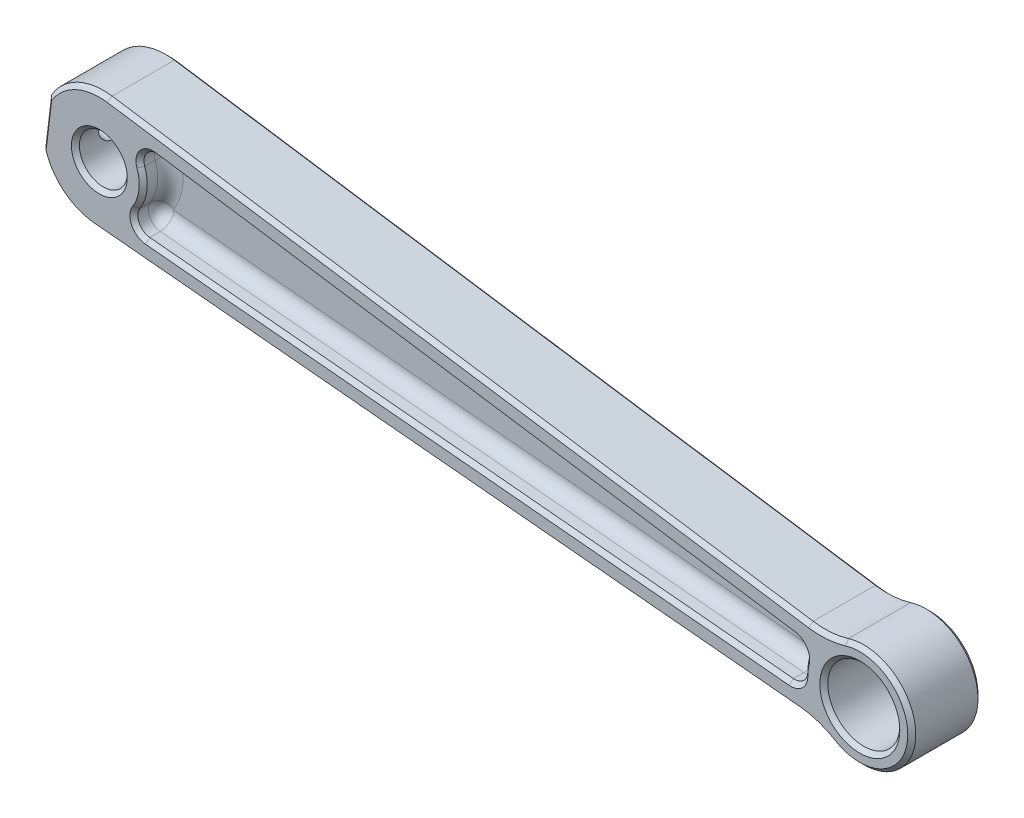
SolidWorks part; units mm, degrees
ref_plane "Front" through (0, 0, 0) normal (0, 0, 1) x (1, 0, 0)
ref_plane "Top" through (0, 0, 0) normal (0, 1, 0) x (1, 0, 0)
ref_plane "Right" through (0, 0, 0) normal (1, 0, 0) x (0, 0, -1)
ref_plane "Front-2.74_00_000" through (0, 0, 0) normal (0, 0, 1) x (1, 0, 0)
ref_plane "Top-2.74_00_000" through (0, 0, 0) normal (0, 1, 0) x (1, 0, 0)
ref_plane "Right-2.74_00_000" through (0, 0, 0) normal (1, 0, 0) x (0, 0, -1)
sketch "layout-2.74_00_000" plane through (0, 0, 0) normal (0, 0, 1) x (1, 0, 0)
  line L0 (0, -7) -> (10.8027, -56.8428) construction
  line L7 (10.8027, -56.8428) -> (106.1067, -68.3815) construction
  line L8 (4.2363, -26.5462) -> (99.5404, -38.0849) construction
  line L9 (99.5404, -38.0849) -> (126.4411, -162.2032) construction
  line L10 (17, 41.5) -> (-7.5, 41.5) construction
  line L11 (20, 55) -> (20, 0)
  line L12 (20, 55) -> (-20, 55)
  line L13 (-20, 55) -> (-20, 0)
  line L14 (-7.5, 51.5) -> (7.5, 51.5) construction
  line L15 (7.5, 51.5) -> (7.5, 31.5) construction
  line L17 (-7.5, 51.5) -> (-7.5, 31.5) construction
  line L18 (7.5, 31.5) -> (-7.5, 31.5) construction
  line L19 (17, 55) -> (17, 28)
  line L20 (17, 55) -> (-17, 55)
  line L21 (-17, 55) -> (-17, 28)
  line L22 (17, 28) -> (-17, 28)
  line L23 (0, 55) -> (0, 41.5) construction
  circle A0 centre (7.5, 51.5) radius 1.55
  circle A9 centre (7.5, 31.5) radius 1.55
  circle A10 centre (-7.5, 31.5) radius 1.55
  circle A11 centre (-7.5, 51.5) radius 1.55
  circle A12 centre (0, 0) radius 20
  circle B0 centre (0, 0) radius 15.5 construction
  circle B1 centre (0, -7) radius 6.25
  circle B2 centre (0, 0) radius 20
  circle B3 centre (15.5, 0) radius 1.5
  circle B4 centre (7.75, -13.4234) radius 1.5
  circle B5 centre (-7.75, -13.4234) radius 1.5
  circle B6 centre (-15.5, 0) radius 1.5
  circle B7 centre (-7.75, 13.4234) radius 1.5
  circle B8 centre (7.75, 13.4234) radius 1.5
  circle B9 centre (0, 0) radius 18.4
  circle B10 centre (0, -7) radius 3
  circle B11 centre (9.3199, -50.0016) radius 15.5 construction
  circle B12 centre (10.8027, -56.8428) radius 6.25
  circle B13 centre (9.3199, -50.0016) radius 20
  circle B14 centre (24.4682, -46.7185) radius 1.5
  circle B15 centre (19.7374, -61.4788) radius 1.5
  circle B16 centre (4.5891, -64.762) radius 1.5
  circle B17 centre (-5.8284, -53.2848) radius 1.5
  circle B18 centre (-1.0975, -38.5244) radius 1.5
  circle B19 centre (14.0508, -35.2412) radius 1.5
  circle B20 centre (9.3199, -50.0016) radius 18.4
  circle B21 centre (10.8027, -56.8428) radius 3
sketch_block_instance "motorMount-2-1"
sketch_block "motorMount-2" parameters "D1"=31, "D2"=12.5, "D4"=40, "D5"=3, "D6"=36.8, "D7"=5.828, "D3"=7
sketch_block_instance "motorMount-2" parameters "D1"=39.5436, "D3"=12.0659, "D5"=37.1352, "D6"=2.3003, "D8"=36.8, "D11"=35.5941, "D9"=3.2987, "D4"=6.928, "D7"=74.6883, "D2"=59.5318, "D10"=34
ref_plane "profile plane-2.74_00_000" through (-1.4491, -0.3141, 0) normal (-0.9773, -0.2118, 0) x (0.2118, -0.9773, 0)
sketch "profile-2.74_00_000" plane through (1.4811, -13.8336, 0) normal (0.9773, 0.2118, 0) x (-0.2118, 0.9773, 0)
  line L1 (-44.0077, 0) -> (-44.0077, 36.4175) construction
  line L2 (-13.0077, 0) -> (-13.0077, 31.3) construction
  line L3 (11.2423, 12.5) -> (-17.0077, 12.5)
  line L4 (6.9923, 0) -> (6.9923, 30.0757) construction
  line L5 (-0.5077, 11.3) -> (14.4923, 11.3)
  line L6 (-0.5077, 11.3) -> (-0.5077, 6.3)
  line L7 (-0.5077, 6.3) -> (14.4923, 6.3)
  line L8 (14.4923, 11.3) -> (14.4923, 6.3)
  line L9 (3.9923, 11.3) -> (3.9923, 6.3)
  line L10 (9.9923, 11.3) -> (9.9923, 6.3)
  line L15 (-0.5204, 11.3) -> (-0.5204, 6.3)
  line L16 (0.7296, 6.3) -> (0.7296, 0)
  line L17 (0.7296, 0) -> (33.7784, 0)
  line L18 (33.7784, 0) -> (33.7784, 11.3)
  line L19 (33.7784, 11.3) -> (-0.5204, 11.3)
  line L20 (2.7423, 12.5) -> (2.7423, 11.3)
  line L21 (2.7423, 11.3) -> (11.2423, 11.3)
  line L22 (11.2423, 12.5) -> (11.2423, 11.3)
  line L23 (15.9923, 20.5) -> (-51.5204, 20.5)
  line L24 (15.9923, 20.5) -> (15.9923, 12.5)
  line L25 (15.9923, 12.5) -> (2.7423, 12.5)
  line L26 (-51.5204, 20.5) -> (-51.5204, 15.2)
  line L27 (15.9923, 18.5) -> (9.9923, 18.5)
  line L28 (15.9923, 18.5) -> (15.9923, 14.5)
  line L29 (15.9923, 14.5) -> (9.9923, 14.5)
  line L30 (9.9923, 18.5) -> (9.9923, 14.5)
  line L31 (-0.5204, 6.3) -> (0.7296, 6.3)
  line L33 (14.505, 11.3) -> (14.505, 6.3)
  line L34 (-51.5077, 20.5) -> (-36.5077, 20.5)
  line L35 (-51.5077, 20.5) -> (-51.5077, 15.5)
  line L36 (-51.5077, 15.5) -> (-36.5077, 15.5)
  line L37 (-36.5077, 20.5) -> (-36.5077, 15.5)
  line L38 (14.505, 6.3) -> (13.255, 6.3)
  line L39 (13.255, 6.3) -> (13.255, 0)
  line L40 (13.255, 0) -> (-6.1115, 0)
  line L41 (-6.1115, 0) -> (-6.1115, 11.3)
  line L42 (-6.1115, 11.3) -> (14.505, 11.3)
  line L43 (11.2423, 12.5) -> (11.2423, 20.5) construction
  line L44 (2.7423, 12.5) -> (11.2423, 12.5) construction
  line L45 (8.3163, 6) -> (8.3163, 6.3) construction
  line L46 (-50.2577, 15.2) -> (-50.2577, 15.5) construction
  line L47 (-51.5204, 15.2) -> (-50.2704, 15.2)
  line L48 (-48.2577, 22.7) -> (-39.7577, 22.7) construction
  line L49 (-48.2577, 22.7) -> (-48.2577, 21.5)
  line L50 (-48.2577, 21.5) -> (-39.7577, 21.5)
  line L51 (-39.7577, 22.7) -> (-39.7577, 21.5)
  line L56 (-50.2704, 15.2) -> (-50.2704, 9.2)
  line L57 (-50.2704, 9.2) -> (-17.0077, 9.2)
  line L58 (-37.0077, 9.2) -> (-37.0077, 0) construction
  line L59 (-17.0077, 9.2) -> (-57.0077, 9.2)
  line L60 (-17.0077, 9.2) -> (-17.0077, -55.8)
  line L61 (-17.0077, -55.8) -> (-57.0077, -55.8)
  line L62 (-57.0077, 9.2) -> (-57.0077, -55.8)
  line L63 (-17.5204, 29.8) -> (-17.5204, 21.8)
  line L64 (-17.5204, 21.8) -> (-16.7204, 21.8)
  line L65 (-17.0077, 9.2) -> (-17.0077, 12.5)
  line L66 (-16.7204, 21.8) -> (-16.7204, 21)
  line L67 (-17.5077, 25.8) -> (-8.5077, 25.8)
  line L68 (-17.5077, 25.8) -> (-17.5077, 21.8)
  line L69 (-17.5077, 21.8) -> (-8.5077, 21.8)
  line L70 (-8.5077, 25.8) -> (-8.5077, 21.8)
  line L71 (-15.0077, 31.3) -> (-11.0077, 31.3)
  line L72 (-15.0077, 31.3) -> (-15.0077, 12.5)
  line L73 (-15.0077, 12.5) -> (-11.0077, 12.5)
  line L74 (-11.0077, 31.3) -> (-11.0077, 12.5)
  line L75 (-17.5077, 29.8) -> (-8.5077, 29.8)
  line L76 (-17.5077, 29.8) -> (-17.5077, 25.8)
  line L77 (-17.5077, 25.8) -> (-8.5077, 25.8)
  line L78 (-8.5077, 29.8) -> (-8.5077, 25.8)
  line L79 (-19.5204, 29.8) -> (-6.495, 29.8)
  line L80 (-19.5204, 29.8) -> (-19.5204, 21)
  line L81 (-19.5204, 21) -> (-16.7204, 21)
  line L83 (-15.0077, 20.5) -> (-15.0077, 21.8)
  line L84 (-6.495, 29.8) -> (-6.495, 21)
  line L85 (-6.495, 21) -> (-9.295, 21)
  line L86 (-9.295, 21.8) -> (-9.295, 21)
  line L87 (-8.495, 21.8) -> (-9.295, 21.8)
  line L88 (-8.495, 29.8) -> (-8.495, 21.8)
  line L89 (-15.0077, 21.8) -> (-15.8077, 21.8)
  line L90 (-15.8077, 21.8) -> (-15.8077, 20.5)
  line L91 (-19.5204, 31.3) -> (-16.3204, 31.3)
  line L92 (-16.2577, 30.3) -> (-14.9077, 30.3)
  line L93 (-16.2577, 30.3) -> (-16.2577, 29.8)
  line L94 (-16.2577, 29.8) -> (-14.9077, 29.8)
  line L95 (-14.9077, 30.3) -> (-14.9077, 29.8)
  line L96 (-19.5204, 31.3) -> (-19.5204, 29.8)
  line L97 (-19.5204, 29.8) -> (-16.3204, 29.8)
  line L98 (-16.3204, 31.3) -> (-16.3204, 29.8)
  point P75 (-17.0077, 0)
  line B0 (6.9923, 0) -> (6.9923, 21.6) construction
  line B1 (0.7423, 0) -> (13.2423, 0)
  line B2 (0.7423, 0) -> (0.7423, 6)
  line B3 (0.7423, 6) -> (13.2423, 6)
  line B4 (13.2423, 0) -> (13.2423, 6)
  line B5 (3.9923, 0) -> (9.9923, 0)
  line B6 (3.9923, 0) -> (3.9923, 21.6)
  line B7 (3.9923, 21.6) -> (9.9923, 21.6)
  line B8 (9.9923, 0) -> (9.9923, 21.6)
  line B9 (3.9923, 9.6) -> (9.9923, 9.6) construction
  line B10 (-44.0077, 9.2) -> (-44.0077, 30.8) construction
  line B11 (-50.2577, 9.2) -> (-37.7577, 9.2)
  line B12 (-50.2577, 9.2) -> (-50.2577, 15.2)
  line B13 (-50.2577, 15.2) -> (-37.7577, 15.2)
  line B14 (-37.7577, 9.2) -> (-37.7577, 15.2)
  line B15 (-47.0077, 9.2) -> (-41.0077, 9.2)
  line B16 (-47.0077, 9.2) -> (-47.0077, 30.8)
  line B17 (-47.0077, 30.8) -> (-41.0077, 30.8)
  line B18 (-41.0077, 9.2) -> (-41.0077, 30.8)
  line B19 (-47.0077, 18.8) -> (-41.0077, 18.8) construction
sketch_block_instance "motorShaft-2-2"
sketch_block "motorShaft-2" parameters "D1"=6, "D2"=15.6, "D3"=12
sketch_block_instance "motorShaft-2" parameters "D1"=10.3781, "D2"=6.071, "D3"=6.071, "D4"=0.9006, "D5"=1.18, "D6"=8.8991, "D7"=8.3575, "D8"=15, "D9"=4.2047, "D10"=15, "D11"=15, "D12"=92.6341, "D13"=92.6341, "D14"=1.1226, "D15"=10.7263, "clearance offset"=0.0127, "D16"=9, "D17"=9.3918, "D18"=6, "D19"=5, "D20"=7.7663, "D21"=27.4813, "D22"=5, "D23"=13, "D24"=13, "D25"=1.3445, "D26"=8, "D27"=1, "D28"=0.9192, "D29"=2.2, "D30"=2.2, "D31"=4, "D32"=0.7961, "D33"=0.5, "D34"=4.9986, "D35"=1.35, "D36"=1.35, "D37"=13, "D38"=1.614, "D39"=1.614, "D40"=10.5262, "D41"=10.5262, "D42"=9, "D43"=7.2, "D44"=6.3615
ref_plane "linkage plane-2.74_00_000" through (0, 0, 21) normal (0, 0, 1) x (1, 0, 0)
sketch "linkage layout-2.74_00_000" plane through (0, 0, 21) normal (0, 0, 1) x (1, 0, 0)
  line L0 (11.9065, -49.4245) -> (102.5672, -62.9146)
  line L1 (7.472, -20.8941) -> (94.1623, -34.4119)
  line L3 (4.2363, -26.5462) -> (99.5404, -38.0849) construction
  line L5 (10.8027, -56.8428) -> (106.1067, -68.3815) construction
  line L6 (6.0296, -32.8071) -> (93.4411, -40.3684)
  line L7 (10.1042, -64.3102) -> (101.3648, -72.8458)
  line L9 (105.9053, -36.7054) -> (112.4716, -67.002)
  line L10 (99.5404, -38.0849) -> (125.1702, -156.3394) construction
  line L11 (112.4794, -67.0383) -> (131.0412, -155.1019)
  line L12 (93.1754, -39.4644) -> (99.7418, -69.761)
  line L13 (99.7497, -69.7973) -> (119.3137, -157.6437)
  circle A0 centre (4.2363, -26.5462) radius 6.5127
  circle A1 centre (99.5404, -38.0849) radius 6.5127
  circle A2 centre (10.8027, -56.8428) radius 7.5
  circle A3 centre (106.1067, -68.3815) radius 6.5127
  circle A4 centre (4.2363, -26.5462) radius 4.5127
  circle A5 centre (4.2363, -26.5462) radius 2
  circle A6 centre (99.5404, -38.0849) radius 2
  circle A7 centre (99.5404, -38.0849) radius 4.5127 construction
  circle A8 centre (106.1067, -68.3815) radius 2
  circle A9 centre (106.1067, -68.3815) radius 4.5127
  circle A10 centre (99.5404, -38.0849) radius 3.5
  circle A11 centre (125.1702, -156.3394) radius 6
  circle A12 centre (125.1702, -156.3394) radius 2
  circle A13 centre (99.5404, -38.0849) radius 5.5
  point P4 (9.214, -49.513)
  point P42 (2.8568, -20.1813)
  dimension "D4" = 12
  dimension "D5" = 4
  dimension "D6" = 7
  dimension "D7" = 2
  dimension "D1" = 6
  dimension "D2" = 10
  dimension "D3" = 12
ref_plane "lower leg plane-2.74_00_000" through (87.1904, 18.8972, 0) normal (-0.9773, -0.2118, 0) x (0.2118, -0.9773, 0)
sketch "lower leg sketch-2.74_00_000" plane through (87.1904, 18.8972, 0) normal (-0.9773, -0.2118, 0) x (0.2118, -0.9773, 0)
  line L0 (58.3051, 29.8) -> (58.3051, 8.5048) construction
  line L1 (89.3051, 32.3) -> (89.3051, 4.303) construction
  line L4 (56.3051, 31.3) -> (60.3051, 31.3)
  line L5 (56.3051, 31.3) -> (56.3051, 12.5)
  line L6 (56.3051, 12.5) -> (60.3051, 12.5)
  line L7 (60.3051, 31.3) -> (60.3051, 12.5)
  line L8 (51.7924, 20.5) -> (51.7924, 21) construction
  line L9 (51.7924, 20.5) -> (185.3051, 20.5)
  line L10 (51.7924, 20.5) -> (51.7924, 12.5)
  line L11 (51.7924, 12.5) -> (185.3051, 12.5)
  line L12 (185.3051, 20.5) -> (185.3051, 12.5)
  line L14 (56.4051, 30.4) -> (55.0051, 30.4)
  line L15 (55.5051, 20.5) -> (55.5051, 21.8)
  line L16 (55.5051, 21.8) -> (56.3051, 21.8)
  line L17 (56.3051, 21.8) -> (56.3051, 12.5)
  line L18 (56.4051, 30.4) -> (56.4051, 29.9)
  line L19 (56.4051, 29.9) -> (55.0051, 29.9)
  line L20 (55.0051, 30.4) -> (55.0051, 29.9)
  line L21 (53.7924, 21.8) -> (54.5924, 21.8)
  line L22 (54.5924, 21.8) -> (54.5924, 21)
  line L23 (54.5924, 21) -> (51.7924, 21)
  line L24 (51.7924, 21) -> (51.7924, 29.8)
  line L25 (51.7924, 29.8) -> (53.7924, 29.8)
  line L26 (53.7924, 29.8) -> (53.7924, 21.8)
  line L30 (53.8051, 29.8) -> (62.8051, 29.8)
  line L31 (53.8051, 29.8) -> (53.8051, 21.8)
  line L32 (53.8051, 21.8) -> (62.8051, 21.8)
  line L33 (62.8051, 29.8) -> (62.8051, 21.8)
  line L34 (53.7924, 21.8) -> (53.7924, 21) construction
  line L39 (185.3051, 20.5) -> (185.3051, 21) construction
  point P35 (51.7924, 21)
  point P49 (89.3051, 12.5)
  line B0 (87.3051, 12.5) -> (91.3051, 12.5)
  line B1 (84.7924, 21.8) -> (85.5924, 21.8)
  line B2 (91.3051, 31.3) -> (91.3051, 12.5)
  line B3 (84.8051, 21.8) -> (93.8051, 21.8)
  line B4 (84.7924, 21.8) -> (84.7924, 21) construction
  line B5 (84.8051, 29.8) -> (93.8051, 29.8)
  line B6 (86.5051, 21.8) -> (87.3051, 21.8)
  line B7 (87.4051, 29.9) -> (86.0051, 29.9)
  line B8 (87.3051, 31.3) -> (87.3051, 12.5)
  line B9 (85.5924, 21) -> (82.7924, 21)
  line B10 (87.3051, 31.3) -> (91.3051, 31.3)
  line B11 (85.5924, 21.8) -> (85.5924, 21)
  line B12 (87.4051, 30.4) -> (86.0051, 30.4)
  line B13 (86.0051, 30.4) -> (86.0051, 29.9)
  line B14 (86.5051, 20.5) -> (86.5051, 21.8)
  line B15 (82.7924, 29.8) -> (84.7924, 29.8)
  line B16 (87.4051, 30.4) -> (87.4051, 29.9)
  line B17 (82.7924, 21) -> (82.7924, 29.8)
  line B18 (84.8051, 29.8) -> (84.8051, 21.8)
  line B19 (93.8051, 29.8) -> (93.8051, 21.8)
  line B20 (84.7924, 29.8) -> (84.7924, 21.8)
  line B21 (87.3051, 21.8) -> (87.3051, 12.5)
  line B22 (82.7924, 20.5) -> (82.7924, 21) construction
sketch_block_instance "Block4-1-2"
sketch_block "Block4-1" parameters "D1"=0, "D2"=0.8, "D3"=0, "D4"=0.1, "D5"=1.4, "D6"=0, "D7"=0.8, "D8"=0, "D9"=0.8, "D10"=0, "D11"=0.1
ref_plane "middle link plane-2.74_00_000" through (0, 0, 20.5) normal (0, 0, 1) x (1, 0, 0)
sketch "middle_link-2.74_00_000" plane through (0, 0, 20.5) normal (0, 0, 1) x (1, 0, 0)
  line L0 (-8.9931, -6.6469) -> (-10.6647, -49.2169)
  line L1 (8.0399, -2.9552) -> (27.1864, -41.0133)
  circle A0 centre (0, -7) radius 9
  circle A1 centre (9.3199, -50.0016) radius 20
  circle A4 centre (4.2363, -26.5462) radius 2
  point P8 (-1.9064, 1.7958)
inserted part "2.74_00_000"
sketch "Sketch6" plane through (0, 0, 21) normal (0, 0, 1) x (1, 0, 0)
  line L0 (4.3392, -53.0383) -> (3.618, -58.9948)
  line L1 (10.8027, -56.8428) -> (106.1067, -68.3815) construction
  circle A0 centre (10.8027, -56.8428) radius 7.5 construction
  arc A1 (3.618, -58.9948) -> (4.3392, -53.0383) centre (10.8027, -56.8428) ccw
  circle A2 centre (10.8027, -56.8428) radius 3
  dimension "D1" = 6
extrude "Boss-Extrude1" add sketch "Sketch6" along normal up to vertex (8.8 mm away)
sketch "Sketch7" plane through (87.1904, 18.8972, 0) normal (-0.9773, -0.2118, 0) x (0.2118, -0.9773, 0)
  line L0 (82.7924, 29.8) -> (84.7924, 29.8) construction
  line L1 (82.7924, 21) -> (82.7924, 29.8) construction
  line L2 (85.5924, 21.8) -> (85.5924, 21) construction
  line L3 (84.7924, 21.8) -> (85.5924, 21.8) construction
  line L4 (84.7924, 29.8) -> (84.7924, 21.8) construction
  line L5 (82.7924, 29.8) -> (84.7924, 29.8)
  line L6 (82.7924, 21) -> (82.7924, 29.8)
  line L7 (85.5924, 21.8) -> (85.5924, 21)
  line L8 (84.7924, 21.8) -> (85.5924, 21.8)
  line L9 (84.7924, 29.8) -> (84.7924, 21.8)
  line L11 (82.7924, 21) -> (85.5924, 21)
  line L12 (89.3051, 32.3) -> (89.3051, 4.303) construction
  line L13 (89.3051, 32.3) -> (89.3051, 4.303) construction
revolve "Revolve1" add sketch "Sketch7" angle 360 about L13
sketch "Sketch8" plane through (0, 0, 21) normal (0, 0, 1) x (1, 0, 0)
  line L0 (11.9065, -49.4245) -> (102.5672, -62.9146) construction
  line L1 (11.9065, -49.4245) -> (102.5672, -62.9146)
  line L2 (10.1042, -64.3102) -> (101.3648, -72.8458) construction
  line L3 (10.1042, -64.3102) -> (101.3648, -72.8458)
  circle A0 centre (106.1067, -68.3815) radius 6.5127 construction
  arc A1 (102.5672, -62.9146) -> (101.3648, -72.8458) centre (106.1067, -68.3815) ccw
  arc A2 (3.618, -58.9948) -> (4.3392, -53.0383) centre (10.8027, -56.8428) ccw construction
  arc A3 (10.1042, -64.3102) -> (11.9065, -49.4245) centre (10.8027, -56.8428) ccw
extrude "Boss-Extrude2" add sketch "Sketch8" along normal up to vertex (8.8 mm away)
fillet "Fillet2" radius 10 2 edges at (101.3648, -72.8458, 25.4) (102.5672, -62.9146, 25.4)
sketch "Sketch9" plane through (10.6053, -1.284, 0) normal (-0.9928, 0.1202, 0) x (0, 0, 1)
  line L0 (21, -55.1323) -> (25.4, -55.1323) construction
  line L1 (21, -52.1323) -> (21, -58.1323) construction
  line L2 (25.4, -55.1323) -> (25.4, -52.1323) construction
  line L3 (29.8, -52.1323) -> (21, -52.1323) construction
hole_wizard "M3x0.5 Tapped Hole1" positions "Sketch11" profile "Sketch10" tap size "M3x0.5" standard "ANSI Metric"
sketch "Sketch11" plane through (10.6053, -1.284, 0) normal (-0.9928, 0.1202, 0) x (0, 0, 1)
  point P0 (25.4, -55.1323)
sketch "Sketch10" plane through (3.9786, -56.0166, 25.4) normal (0, 0, 1) x (-0.1202, -0.9928, 0)
  line L0 (0, 0) -> (0, 9.2511)
  line L1 (0, 9.2511) -> (1.25, 8.5)
  line L2 (1.25, 8.5) -> (1.25, 6.5)
  line L3 (1.25, 6.5) -> (1.5, 6.5)
  line L4 (1.5, 6.5) -> (1.5, 0)
  line L5 (1.5, 0) -> (0, 0)
  line L10 (0, 9.2511) -> (-1.25, 8.5) construction
  line L11 (0, -6.35) -> (0, 107.95) construction
  dimension "Tap Drill Dia." = 2.5
  dimension "Tap Drill Depth" = 8.5
  dimension "Thread Major Dia." = 3
  dimension "Thread Depth" = 6.5
  dimension "Drill Angle" = 118
sketch "Sketch14" plane through (-6.9371, -46.6206, 0) normal (0.1472, 0.9891, 0) x (0.9891, -0.1472, 0)
  line L0 (19.051, -25.4) -> (107.8696, -25.4) construction
  line L1 (19.051, -29.8) -> (19.051, -21) construction
  line L2 (107.8696, -29.8) -> (107.8696, -21) construction
ref_plane "Plane8" through (0, 0, 25.4) normal (0, 0, 1) x (1, 0, 0)
sketch "Sketch15" plane through (0, 0, 25.4) normal (0, 0, 1) x (1, 0, 0)
  line L5 (10.8027, -56.8428) -> (106.1067, -68.3815) construction
  line L6 (11.5385, -51.8972) -> (102.1992, -65.3874)
  line L7 (17.7864, -52.8269) -> (97.9206, -64.7507)
  line L8 (16.6262, -62.4093) -> (97.2906, -69.9538)
  circle A2 centre (10.8027, -56.8428) radius 5.5
  arc A3 (15.4005, -59.861) -> (15.988, -55.009) centre (10.8027, -56.8428) ccw
  arc A4 (99.0942, -68.3244) -> (97.2906, -69.9538) centre (97.4443, -68.311) cw
  circle A5 centre (106.1067, -68.3815) radius 7.0127
  arc A6 (99.2832, -66.7635) -> (99.0942, -68.3244) centre (106.1067, -68.3815) ccw
  arc A7 (99.2832, -66.7635) -> (97.9206, -64.7507) centre (97.6777, -66.3828) ccw
  arc A8 (15.4005, -59.861) -> (16.6262, -62.4093) centre (16.7799, -60.7665) ccw
  arc A9 (15.988, -55.009) -> (17.7864, -52.8269) centre (17.5436, -54.4589) cw
  dimension "D4" = 1.65
  dimension "D1" = 2.5
  dimension "D2" = 2.5
  dimension "D3" = 2.5
sketch "Sketch16" plane through (0, 0, 25.4) normal (0, 0, 1) x (1, 0, 0)
  line L2 (97.9206, -64.7507) -> (17.7864, -52.8269)
  line L3 (16.6262, -62.4093) -> (97.2906, -69.9538)
  line L4 (97.9206, -64.7507) -> (17.7864, -52.8269)
  line L5 (16.6262, -62.4093) -> (97.2906, -69.9538)
  arc A6 (99.2832, -66.7635) -> (97.9206, -64.7507) centre (97.6777, -66.3828) ccw
  arc A7 (99.2832, -66.7635) -> (99.0942, -68.3244) centre (106.1067, -68.3815) ccw
  arc A8 (97.2906, -69.9538) -> (99.0942, -68.3244) centre (97.4443, -68.311) ccw
  arc A9 (15.4005, -59.861) -> (16.6262, -62.4093) centre (16.7799, -60.7665) ccw
  arc A10 (15.4005, -59.861) -> (15.988, -55.009) centre (10.8027, -56.8428) ccw
  arc A11 (17.7864, -52.8269) -> (15.988, -55.009) centre (17.5436, -54.4589) ccw
  arc A12 (99.2832, -66.7635) -> (97.9206, -64.7507) centre (97.6777, -66.3828) ccw
  arc A13 (99.2832, -66.7635) -> (99.0942, -68.3244) centre (106.1067, -68.3815) ccw
  arc A14 (97.2906, -69.9538) -> (99.0942, -68.3244) centre (97.4443, -68.311) ccw
  arc A15 (15.4005, -59.861) -> (16.6262, -62.4093) centre (16.7799, -60.7665) ccw
  arc A16 (15.4005, -59.861) -> (15.988, -55.009) centre (10.8027, -56.8428) ccw
  arc A17 (17.7864, -52.8269) -> (15.988, -55.009) centre (17.5436, -54.4589) ccw
  dimension "D1" = 0
extrude "Cut-Extrude1" cut sketch "Sketch16" against normal through all from offset 1
mirror "Mirror1" about plane through (0, 0, 25.4) normal (0, 0, 1) of "Cut-Extrude1"
fillet "Fillet3" radius 1.5875 16 edges at (16.2628, -57.5039, 24.4) (15.293, -61.4817, 24.4) (56.9584, -66.1816, 24.4) (98.5504, -69.5354, 24.4) (99.1448, -67.5386, 24.4) (99.0441, -65.4578, 24.4) (57.8535, -58.7888, 24.4) (16.2703, -53.4095, 24.4) (57.8535, -58.7888, 26.4) (99.0441, -65.4578, 26.4) (99.1448, -67.5386, 26.4) (98.5504, -69.5354, 26.4) (56.9584, -66.1816, 26.4) (15.293, -61.4817, 26.4) (16.2628, -57.5039, 26.4) (16.2703, -53.4095, 26.4)
chamfer "Chamfer1" distance 0.5 angle 45 33 edges at (7.5706, -50.0749, 21) (7.5706, -50.0749, 29.8) (54.3205, -68.4457, 21) (54.3205, -68.4457, 29.8) (106.1067, -72.8942, 29.8) (3.9786, -56.0166, 21) (6.0488, -62.6437, 21) (55.8322, -55.9605, 21) (55.8322, -55.9605, 29.8) (100.7231, -73.0362, 21) (100.7231, -73.0362, 29.8) (101.9894, -62.5766, 21) (101.9894, -62.5766, 29.8) (6.0488, -62.6437, 29.8) (16.2703, -53.4095, 21) (57.8535, -58.7888, 21) (99.0441, -65.4578, 21) (99.1448, -67.5386, 21) (98.5504, -69.5354, 21) (56.9584, -66.1816, 21) (15.293, -61.4817, 21) (16.2628, -57.5039, 21) (3.9786, -56.0166, 29.8) (13.8027, -56.8428, 21) (13.8027, -56.8428, 29.8) (16.2703, -53.4095, 29.8) (16.2628, -57.5039, 29.8) (15.293, -61.4817, 29.8) (56.9584, -66.1816, 29.8) (98.5504, -69.5354, 29.8) (99.1448, -67.5386, 29.8) (99.0441, -65.4578, 29.8) (57.8535, -58.7888, 29.8)
